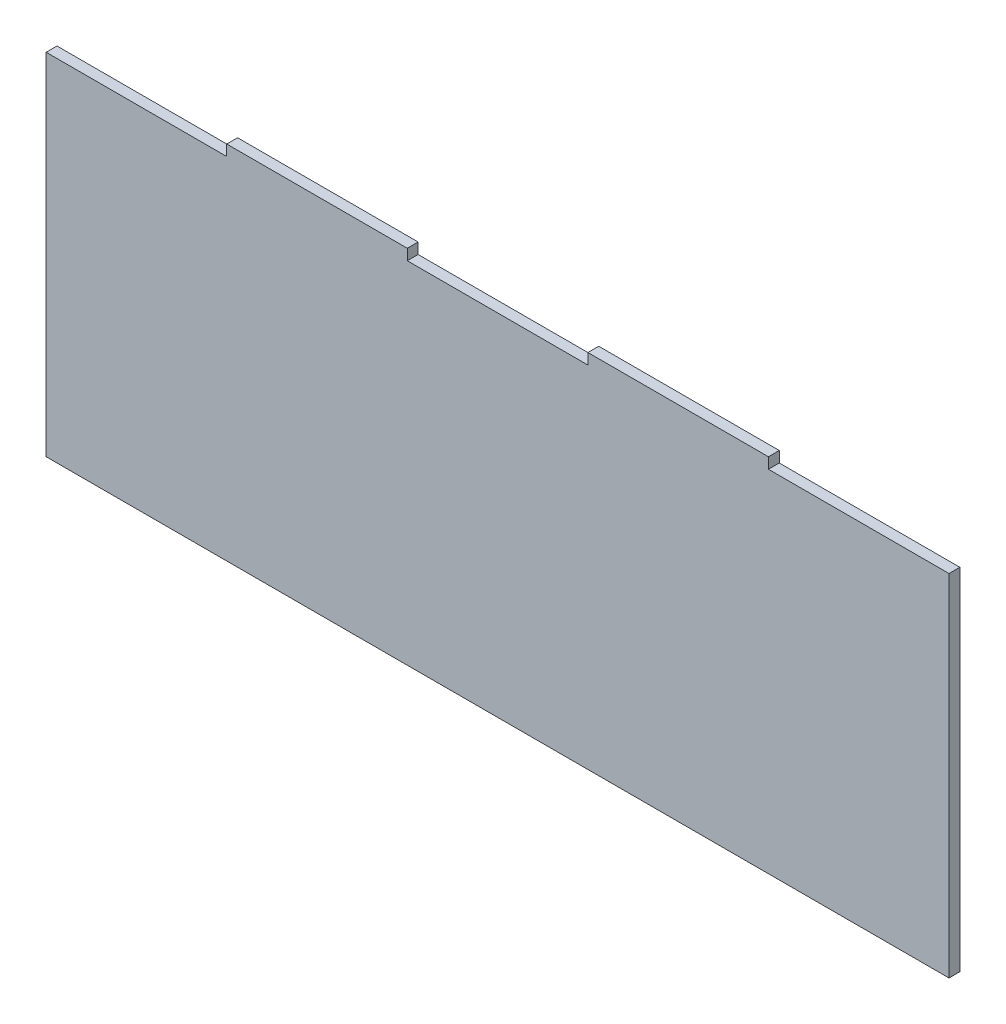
SolidWorks part; units mm, degrees
ref_plane "Front Plane" through (0, 0, 0) normal (0, 0, 1) x (1, 0, 0)
ref_plane "Top Plane" through (0, 0, 0) normal (0, 1, 0) x (1, 0, 0)
ref_plane "Right Plane" through (0, 0, 0) normal (1, 0, 0) x (0, 0, -1)
sketch "Sketch1" plane through (0, 0, 0) normal (0, 0, 1) x (1, 0, 0)
  line L0 (-516.9142, 267.9274) -> (-416.9142, 267.9274)
  line L1 (-416.9142, 273.9274) -> (-316.9142, 273.9274)
  line L2 (-516.9142, 267.9274) -> (-516.9142, 73.9274)
  line L3 (-516.9142, 73.9274) -> (-16.9142, 73.9274)
  line L4 (-16.9142, 267.9274) -> (-16.9142, 73.9274)
  line L5 (-16.9142, 273.9274) -> (-16.9142, 73.9274) construction
  line L7 (-116.9142, 273.9274) -> (-116.9142, 267.9274)
  line L8 (-216.9142, 273.9274) -> (-216.9142, 267.9274)
  line L9 (-316.9142, 273.9274) -> (-316.9142, 267.9274)
  line L10 (-416.9142, 273.9274) -> (-416.9142, 267.9274)
  line L11 (-516.9142, 273.9274) -> (-16.9142, 273.9274) construction
  line L12 (-216.9142, 273.9274) -> (-116.9142, 273.9274)
  line L14 (-116.9142, 273.9274) -> (-116.9142, 73.9274) construction
  line L16 (-116.9142, 267.9274) -> (-16.9142, 267.9274)
  line L17 (-516.9142, 267.9274) -> (-16.9142, 267.9274) construction
  line L19 (-216.9142, 273.9274) -> (-216.9142, 73.9274) construction
  line L21 (-316.9142, 273.9274) -> (-316.9142, 73.9274) construction
  line L22 (-316.9142, 267.9274) -> (-216.9142, 267.9274)
  line L24 (-416.9142, 273.9274) -> (-416.9142, 73.9274) construction
  point P0 (-266.9142, 173.9274)
  dimension "D3" = 6
  dimension "D4" = 100
  dimension "D5" = 100
  dimension "D6" = 100
  dimension "D7" = 100
extrude "Boss-Extrude1" add sketch "Sketch1" along normal blind 6 contours L4 L3 L2 L0 L10 L1 L9 L22 L8 L12 L7 L16
